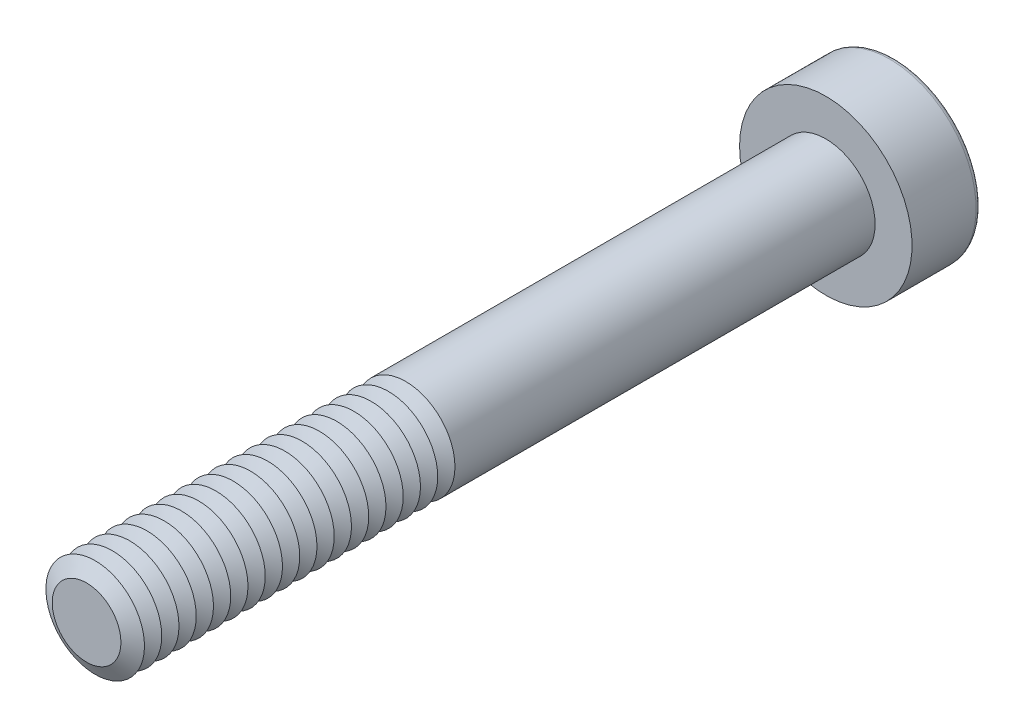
SolidWorks part; units mm, degrees
ref_plane "Front Plane" through (0, 0, 0) normal (0, 0, 1) x (1, 0, 0)
ref_plane "Top Plane" through (0, 0, 0) normal (0, 1, 0) x (1, 0, 0)
ref_plane "Right Plane" through (0, 0, 0) normal (1, 0, 0) x (0, 0, -1)
sketch "Sketch1" plane through (0, 0, 0) normal (0, 0, 1) x (1, 0, 0)
  circle A0 centre (0, 0) radius 2
  dimension "D1" = 4
extrude "Boss-Extrude1" add sketch "Sketch1" along normal blind 30
sketch "Sketch2" plane through (0, 0, 0) normal (0, 0, -1) x (-1, 0, 0)
  circle A0 centre (0, 0) radius 3.5
  dimension "D1" = 7
extrude "Boss-Extrude2" add sketch "Sketch2" along normal blind 2.8
sketch "Sketch3" plane through (0, 0, -2.8) normal (0, 0, -1) x (-1, 0, 0)
  line L1 (-0.7217, 1.25) -> (-1.4434, 0)
  line L2 (-1.4434, 0) -> (-0.7217, -1.25)
  line L3 (-0.7217, -1.25) -> (0.7217, -1.25)
  line L4 (0.7217, -1.25) -> (1.4434, 0)
  line L5 (1.4434, 0) -> (0.7217, 1.25)
  line L6 (0.7217, 1.25) -> (-0.7217, 1.25)
  circle A0 centre (0, 0) radius 1.25 construction
  dimension "D1" = 2.5
extrude "Cut-Extrude1" cut sketch "Sketch3" against normal blind 1.875
fillet "Fillet1" radius 0.2 1 edges at (-3.5, 0, -2.8)
sketch "Sketch4" plane through (0, 0, -0.925) normal (0, 0, -1) x (-1, 0, 0)
  line L0 (0.7217, -1.25) -> (1.4434, 0) construction
  circle A0 centre (0, 0) radius 1.25
extrude "Cut-Extrude2" cut sketch "Sketch4" against normal through all draft 60
sketch "Sketch5" plane through (0, 0, -2.8) normal (0, 0, -1) x (-1, 0, 0)
  circle A0 centre (0, 0) radius 1.4434
extrude "Cut-Extrude3" cut sketch "Sketch5" against normal through all draft 75
sketch "Sketch7" plane through (0, 0, 0) normal (1, 0, 0) x (0, 0, -1)
  line L25 (-30, 1.3938) -> (-29.65, 2)
  line L26 (-30, 2) -> (-30, -2) construction
  line L27 (-29.65, 2) -> (-30.35, 2)
  line L28 (-30.35, 2) -> (-30, 1.3938)
  line L29 (0, 2) -> (-30, 2) construction
  dimension "D1" = 0.7
revolve "Cut-Revolve1" cut sketch "Sketch7" angle 360 about axis through (0, 0, 30) along (0, 0, -1)
pattern_linear "LPattern1" count 19 spacing 0.7 along (0, 0, -1) of "Cut-Revolve1"
